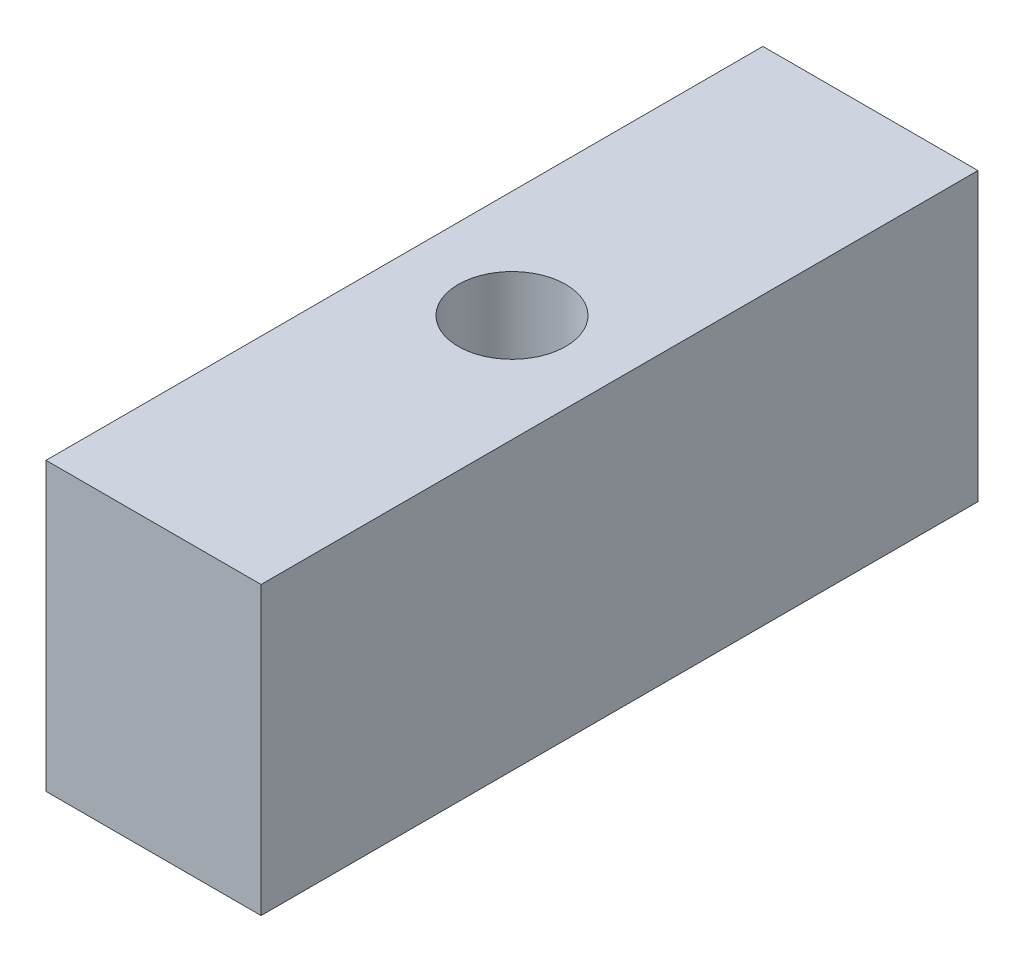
SolidWorks part; units mm, degrees
ref_plane "Plan1" through (0, 0, 0) normal (0, 0, 1) x (1, 0, 0)
ref_plane "Plan2" through (0, 0, 0) normal (0, 1, 0) x (1, 0, 0)
ref_plane "Plan3" through (0, 0, 0) normal (1, 0, 0) x (0, 0, -1)
sketch "Esquisse1" plane through (0, 0, 0) normal (0, 0, 1) x (1, 0, 0)
  line L1 (0, 0) -> (3, 0)
  line L2 (0, 0) -> (0, 4)
  line L3 (0, 4) -> (3, 4)
  line L4 (3, 0) -> (3, 4)
  dimension "D1" = 3
  dimension "D2" = 4
extrude "Base-Extrusion" add sketch "Esquisse1" along normal blind 10
sketch "Esquisse2" plane through (0, 0, 0) normal (0, -1, 0) x (1, 0, 0)
  circle A0 centre (1.5, 5) radius 0.75
  dimension "D3" = 1.5
  dimension "D1" = 5
  dimension "D2" = 1.5
extrude "Enlèv. mat.-Extru.1" cut sketch "Esquisse2" against normal through all
